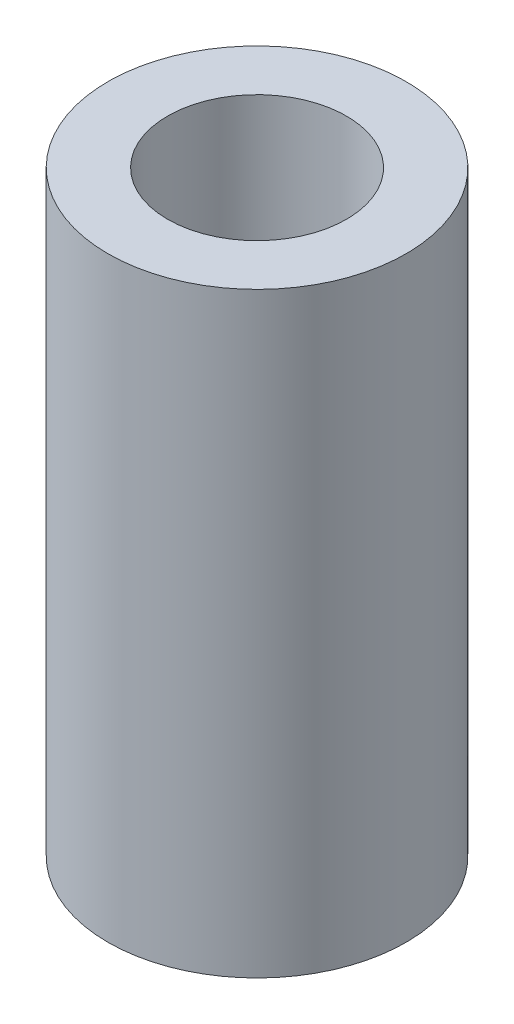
SolidWorks part; units mm, degrees
ref_plane "Front Plane" through (0, 0, 0) normal (0, 0, 1) x (1, 0, 0)
ref_plane "Top Plane" through (0, 0, 0) normal (0, 1, 0) x (1, 0, 0)
ref_plane "Right Plane" through (0, 0, 0) normal (1, 0, 0) x (0, 0, -1)
sketch "Sketch1" plane through (0, 0, 0) normal (0, 1, 0) x (1, 0, 0)
  circle A0 centre (0, 0) radius 1.5
  circle A1 centre (0, 0) radius 2.5
  dimension "D1" = 3
  dimension "D2" = 5
extrude "Boss-Extrude1" add sketch "Sketch1" along normal blind 10
